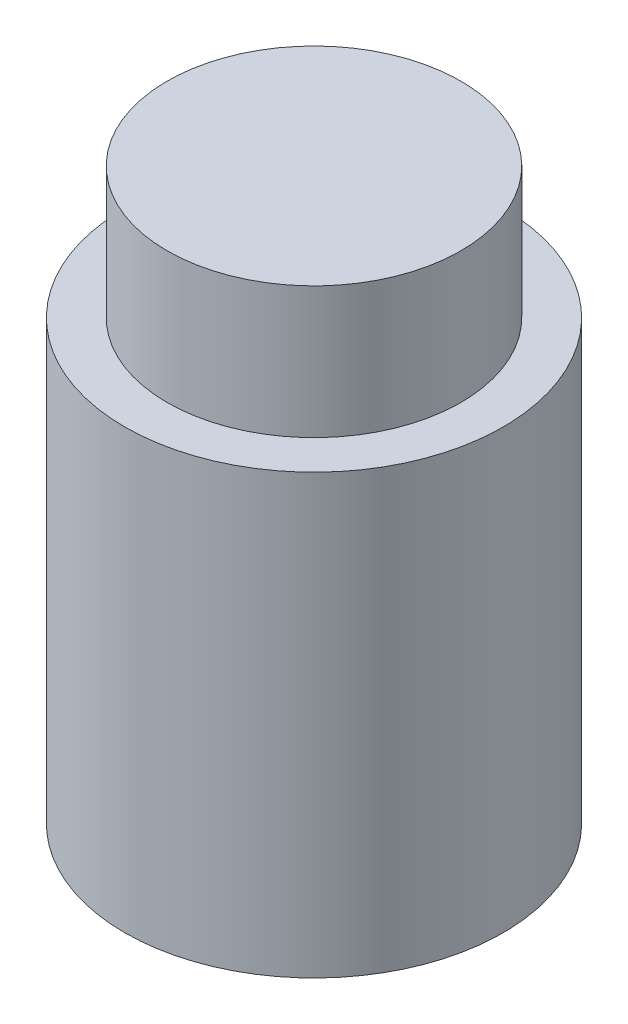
SolidWorks part; units mm, degrees
ref_plane "Front Plane" through (0, 0, 0) normal (0, 0, 1) x (1, 0, 0)
ref_plane "Top Plane" through (0, 0, 0) normal (0, 1, 0) x (1, 0, 0)
ref_plane "Right Plane" through (0, 0, 0) normal (1, 0, 0) x (0, 0, -1)
sketch "Sketch1" plane through (0, 0, 0) normal (0, 1, 0) x (1, 0, 0)
  circle A0 centre (0, 0) radius 10.8
extrude "Boss-Extrude1" add sketch "Sketch1" along normal blind 25
sketch "Sketch2" plane through (0, 25, 0) normal (0, 1, 0) x (1, 0, 0)
  circle A0 centre (0, 0) radius 8.3847
  circle A1 centre (0, 0) radius 10.8 construction
extrude "Boss-Extrude2" add sketch "Sketch2" along normal blind 7.5
